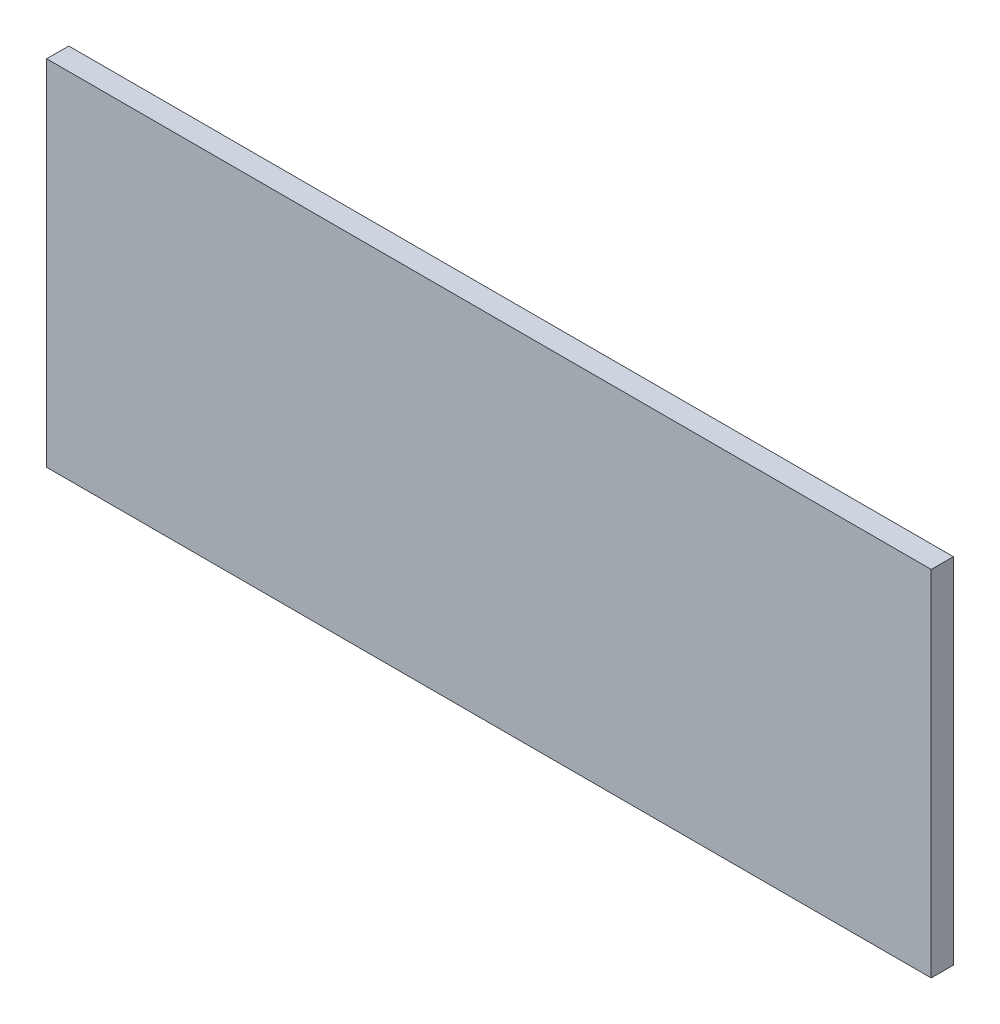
SolidWorks part; units mm, degrees
ref_plane "Front Plane" through (0, 0, 0) normal (0, 0, 1) x (1, 0, 0)
ref_plane "Top Plane" through (0, 0, 0) normal (0, 1, 0) x (1, 0, 0)
ref_plane "Right Plane" through (0, 0, 0) normal (1, 0, 0) x (0, 0, -1)
sketch "Sketch1" plane through (0, 0, 0) normal (0, 1, 0) x (1, 0, 0)
  line L1 (100, 2.5) -> (-100, 2.5)
  line L2 (100, 2.5) -> (100, -2.5)
  line L3 (100, -2.5) -> (-100, -2.5)
  line L4 (-100, 2.5) -> (-100, -2.5)
  line L5 (100, 2.5) -> (-100, -2.5) construction
  line L6 (100, -2.5) -> (-100, 2.5) construction
  point P0 (0, 0)
  dimension "D1" = 5
  dimension "D2" = 200
extrude "Boss-Extrude1" add sketch "Sketch1" along normal blind 80
